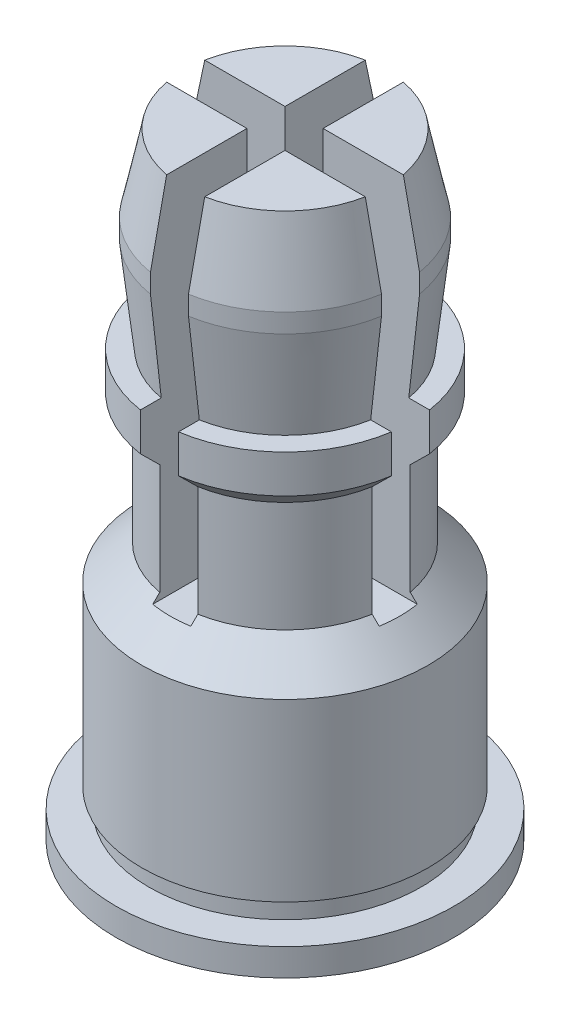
SolidWorks part; units mm, degrees
revolve "Body" add sketch "BodySke" angle 360 about L9
sketch "BodySke" plane through (0, 0, 0) normal (0, 0, 1) x (1, 0, 0)
  line L0 (2.5555, 0.51) -> (2.5555, 0.8925)
  line L1 (2.69, 4.1891) -> (2.0272, 4.8518)
  line L3 (2.0272, 4.8518) -> (2.0272, 6.9267)
  line L4 (0, 0) -> (3.175, 0)
  line L5 (3.175, 0) -> (3.175, 0.51)
  line L6 (3.175, 0.51) -> (2.5555, 0.51)
  line L7 (2.385, 7.2845) -> (2.385, 8)
  line L8 (2.69, 0.8925) -> (2.69, 4.1891)
  line L9 (0, 0) -> (0, 17.145) construction
  line L10 (2.385, 8) -> (2, 8)
  line L11 (2, 8) -> (2.2, 9.79)
  line L12 (2.2, 9.79) -> (2.2, 10.148)
  line L13 (2.2, 10.148) -> (1.9, 11.58)
  line L14 (1.9, 11.58) -> (0, 11.58)
  line L15 (2.5555, 0.8925) -> (2.69, 0.8925)
  line L17 (0, 11.58) -> (0, 0)
  line L19 (2.385, 7.2845) -> (2.0272, 6.9267)
ref_plane "Plane1" through (0, 0, 0) normal (0, 0, 1) x (1, 0, 0)
ref_plane "Plane2" through (0, 0, 0) normal (0, 1, 0) x (1, 0, 0)
ref_plane "Plane3" through (0, 0, 0) normal (1, 0, 0) x (0, 0, -1)
other "Configuration Table"
sketch "SlitCutSke" plane through (0, 11.58, 0) normal (0, 1, 0) x (-1, 0, 0)
  line L0 (-2.6661, 0.3578) -> (2.6661, 0.3578)
  line L1 (2.6661, -0.3578) -> (-2.6661, -0.3578)
  line L2 (-2.6661, 0.3578) -> (-2.6661, -0.3578)
  line L3 (2.6661, 0.3578) -> (2.6661, -0.3578)
  line L4 (-4.064, 0) -> (4.064, 0) construction
  circle A1 centre (0, 0) radius 2.69 construction
extrude "SlitCut" cut sketch "SlitCutSke" against normal blind 6.8582
pattern_circular "SlitCutPat" count 2 every 90 about axis through (0, 0, 0) along (0, 1, 0) of "SlitCut"
ref_plane "Plane4" through (0, -0.5486, 0) normal (0, 1, 0) x (-1, 0, 0)
equation "' \"Panel_dia@BodySke\" = 4"
equation "' \"Length@BodySke\" = 8"
equation "' \"B_dia@BodySke\" = 4.77"
equation "' \"C_dia@BodySke\" = 5.38"
equation "' \"D_ht@BodySke\" = 3.58"
equation "' \"H_dia@BodySke\" = 6.35"
equation "' \"T_ht@BodySke\" = 0.51"
equation "\"Tip_dia@BodySke\" = \"Panel_dia@BodySke\" * 0.95"
equation "\"Slip_dia@BodySke\" = \"Panel_dia@BodySke\" * 1.1"
equation "\"Slip_ht@BodySke\" = \"D_ht@BodySke\" * 0.1"
equation "\"Grip_ht@BodySke\" = \"D_ht@BodySke\" * 0.5"
equation "\"B_ht@BodySke\" = \"B_dia@BodySke\" * 0.15"
equation "\"Neck_dia@BodySke\" = \"B_dia@BodySke\" * 0.85"
equation "\"Neck_len@BodySke\" = \"B_dia@BodySke\" * 0.66"
equation "\"Groove_dia@BodySke\" = \"C_dia@BodySke\" * 0.95"
equation "\"Groove_wid@BodySke\" = \"T_ht@BodySke\" * 0.75"
equation "\"Width@SlitCutSke\" = \"B_ht@BodySke\""
equation "\"Depth@SlitCut\" = \"D_ht@BodySke\" + \"Neck_len@BodySke\" + 0.13"
